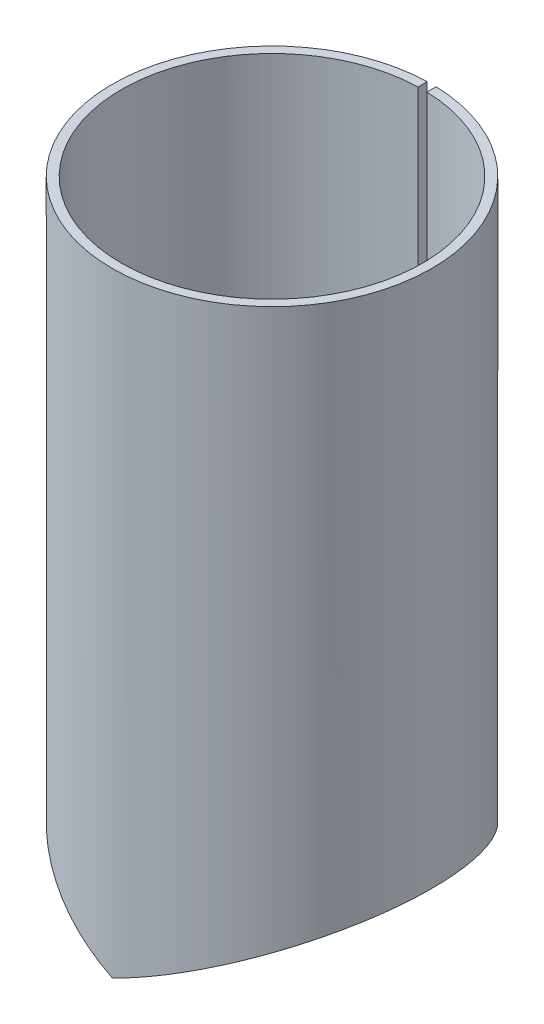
SolidWorks part; units mm, degrees
ref_plane "前视基准面" through (0, 0, 0) normal (0, 0, 1) x (1, 0, 0)
ref_plane "上视基准面" through (0, 0, 0) normal (0, 1, 0) x (1, 0, 0)
ref_plane "右视基准面" through (0, 0, 0) normal (1, 0, 0) x (0, 0, -1)
imported_body "基体零件-带补料的任意角Y形三通管-1"
sheet metal parameters "钣金1" parameters "D1"=0.7366, "厚度"=1
bend "圆角折弯1" bend radius 16.4845 bend angle 356.723 parameters "D5"=1
flatten bends "展开-折弯1"
sketch "尖角-草图1" plane through (-0.5, 33.7656, -17.4773) normal (-0.0286, 0, -0.9996) x (-0.9996, 0, 0.0286)
  line L0 (51.316, 33.5231) -> (51.316, -33.5231) construction
  dimension "D1" = 0
process bends "加工-折弯1" parameters "D1"=0
sketch "平面-草图1" plane through (-0.5, 33.7656, -17.4773) normal (-0.0286, 0, -0.9996) x (-0.9996, 0, 0.0286)
